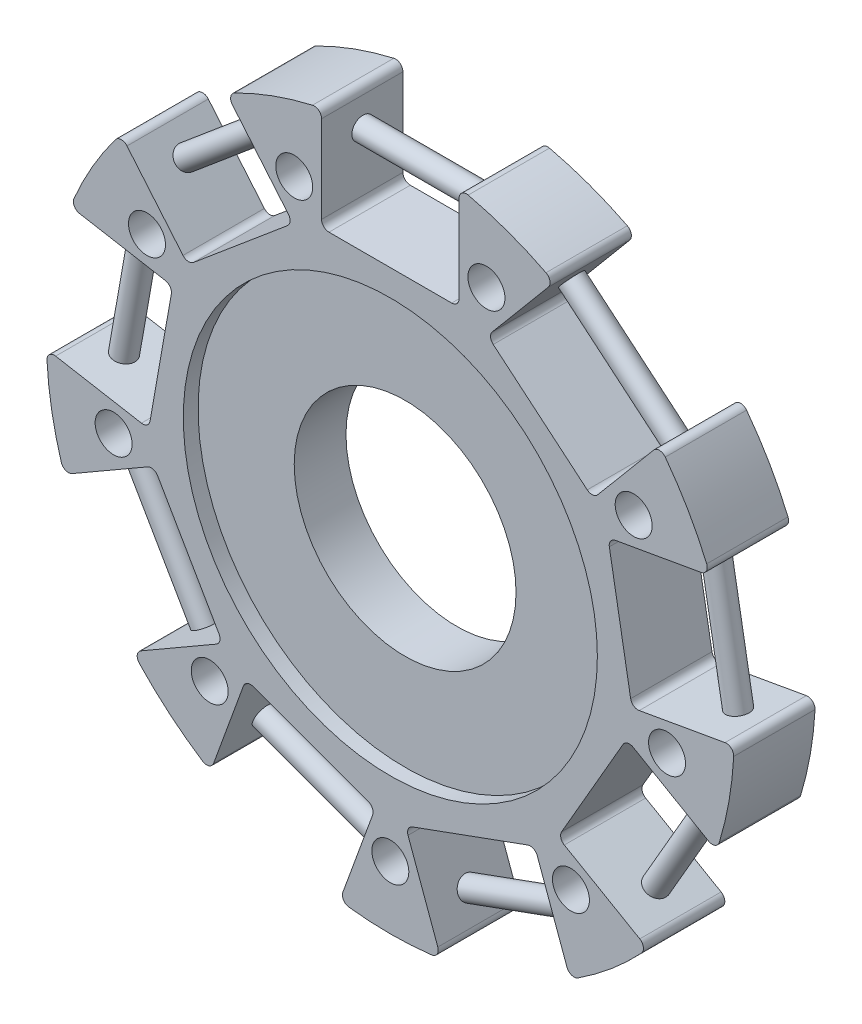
SolidWorks part; units mm, degrees
ref_plane "Front Plane" through (0, 0, 0) normal (0, 0, 1) x (1, 0, 0)
ref_plane "Top Plane" through (0, 0, 0) normal (0, 1, 0) x (1, 0, 0)
ref_plane "Right Plane" through (0, 0, 0) normal (1, 0, 0) x (0, 0, -1)
sketch "Sketch1" plane through (0, 0, 0) normal (0, 0, 1) x (1, 0, 0)
  line L0 (0, 0) -> (0, 31.5376) construction
  line L3 (8.3, 31.5376) -> (-8.3, 31.5376)
  line L4 (-9.3, 32.5376) -> (-9.3, 44.3225)
  line L5 (26.6302, 18.8241) -> (13.9138, 29.4944)
  line L7 (13.7906, 30.9032) -> (21.3657, 39.9309)
  line L8 (-42.0342, 16.8552) -> (-30.4284, 14.8088)
  line L9 (35.6142, 27.9751) -> (28.039, 18.9473)
  line L10 (32.4998, -2.6975) -> (29.6172, 13.6504)
  line L11 (30.4284, 14.8088) -> (42.0342, 16.8552)
  line L13 (45.2641, -1.4622) -> (33.6582, -3.5086)
  line L14 (23.1624, -22.9568) -> (31.4624, -8.5808)
  line L15 (32.8284, -8.2148) -> (43.0344, -14.1072)
  line L16 (-43.0344, -14.1072) -> (-32.8284, -8.2148)
  line L18 (2.9871, -32.4744) -> (18.586, -26.7969)
  line L19 (19.8677, -27.3946) -> (23.8983, -38.4687)
  line L22 (-18.586, -26.7969) -> (-2.9871, -32.4744)
  line L23 (-2.3894, -33.7562) -> (-6.42, -44.8303)
  line L25 (-23.8983, -38.4687) -> (-19.8677, -27.3946)
  line L26 (-31.4624, -8.5808) -> (-23.1624, -22.9568)
  line L27 (-23.5284, -24.3229) -> (-33.7344, -30.2153)
  line L30 (-29.6172, 13.6504) -> (-32.4998, -2.6975)
  line L31 (-33.6582, -3.5086) -> (-45.2641, -1.4622)
  line L32 (33.7344, -30.2153) -> (23.5284, -24.3229)
  line L34 (-13.9138, 29.4944) -> (-26.6302, 18.8241)
  line L35 (-28.039, 18.9473) -> (-35.6142, 27.9751)
  line L37 (-21.3657, 39.9309) -> (-13.7906, 30.9032)
  line L48 (9.3, 44.3225) -> (9.3, 32.5376)
  line L49 (6.42, -44.8303) -> (2.3894, -33.7562)
  arc A0 (-21.0524, 41.4654) -> (-21.3657, 39.9309) centre (-20.5997, 40.5737) ccw
  arc A1 (-10.5264, 45.2965) -> (-21.0524, 41.4654) centre (0, 0) ccw
  arc A2 (-10.5264, 45.2965) -> (-9.3, 44.3225) centre (-10.3, 44.3225) cw
  arc A3 (-37.1797, 27.9329) -> (-35.6142, 27.9751) centre (-36.3802, 27.3323) cw
  arc A4 (-42.7805, 18.2321) -> (-42.0342, 16.8552) centre (-41.8605, 17.84) ccw
  arc A5 (-46.4363, -2.5008) -> (-45.2641, -1.4622) centre (-45.4377, -2.447) cw
  arc A6 (-44.4911, -13.5322) -> (-43.0344, -14.1072) centre (-43.5344, -13.2412) ccw
  arc A7 (-33.9648, -31.7644) -> (-33.7344, -30.2153) centre (-33.2344, -31.0813) cw
  arc A8 (-25.3839, -38.9646) -> (-23.8983, -38.4687) centre (-24.838, -38.1267) ccw
  arc A9 (5.6008, -46.165) -> (6.42, -44.8303) centre (5.4803, -45.1723) ccw
  arc A10 (-5.6008, -46.165) -> (-6.42, -44.8303) centre (-5.4803, -45.1723) cw
  arc A11 (33.9648, -31.7644) -> (33.7344, -30.2153) centre (33.2344, -31.0813) ccw
  arc A12 (25.3839, -38.9646) -> (23.8983, -38.4687) centre (24.838, -38.1267) cw
  arc A13 (-37.1797, 27.9329) -> (-42.7805, 18.2321) centre (0, 0) ccw
  arc A14 (44.4911, -13.5322) -> (43.0344, -14.1072) centre (43.5344, -13.2412) cw
  arc A15 (-46.4363, -2.5008) -> (-44.4911, -13.5322) centre (0, 0) ccw
  arc A16 (46.4363, -2.5008) -> (45.2641, -1.4622) centre (45.4377, -2.447) ccw
  arc A17 (-33.9648, -31.7644) -> (-25.3839, -38.9646) centre (0, 0) ccw
  arc A18 (42.0342, 16.8552) -> (42.7805, 18.2321) centre (41.8605, 17.84) ccw
  arc A19 (-5.6008, -46.165) -> (5.6008, -46.165) centre (0, 0) ccw
  arc A20 (37.1797, 27.9329) -> (35.6142, 27.9751) centre (36.3802, 27.3323) ccw
  arc A21 (25.3839, -38.9646) -> (33.9648, -31.7644) centre (0, 0) ccw
  arc A22 (44.4911, -13.5322) -> (46.4363, -2.5008) centre (0, 0) ccw
  arc A23 (21.0524, 41.4654) -> (21.3657, 39.9309) centre (20.5997, 40.5737) cw
  arc A24 (42.7805, 18.2321) -> (37.1797, 27.9329) centre (0, 0) ccw
  arc A25 (10.5264, 45.2965) -> (9.3, 44.3225) centre (10.3, 44.3225) ccw
  arc A26 (21.0524, 41.4654) -> (10.5264, 45.2965) centre (0, 0) ccw
  arc A27 (-23.1624, -22.9568) -> (-23.5284, -24.3229) centre (-24.0284, -23.4568) cw
  arc A28 (-18.586, -26.7969) -> (-19.8677, -27.3946) centre (-18.928, -27.7366) ccw
  arc A29 (-2.9871, -32.4744) -> (-2.3894, -33.7562) centre (-3.3291, -33.4141) cw
  arc A30 (2.9871, -32.4744) -> (2.3894, -33.7562) centre (3.3291, -33.4141) ccw
  arc A31 (18.586, -26.7969) -> (19.8677, -27.3946) centre (18.928, -27.7366) cw
  arc A32 (23.1624, -22.9568) -> (23.5284, -24.3229) centre (24.0284, -23.4568) ccw
  arc A33 (31.4624, -8.5808) -> (32.8284, -8.2148) centre (32.3284, -9.0808) cw
  arc A34 (32.4998, -2.6975) -> (33.6582, -3.5086) centre (33.4846, -2.5238) ccw
  arc A35 (29.6172, 13.6504) -> (30.4284, 14.8088) centre (30.602, 13.824) cw
  arc A36 (26.6302, 18.8241) -> (28.039, 18.9473) centre (27.273, 19.5901) ccw
  arc A37 (-32.4998, -2.6975) -> (-33.6582, -3.5086) centre (-33.4846, -2.5238) cw
  arc A38 (-31.4624, -8.5808) -> (-32.8284, -8.2148) centre (-32.3284, -9.0808) ccw
  arc A39 (13.9138, 29.4944) -> (13.7906, 30.9032) centre (14.5566, 30.2604) cw
  arc A40 (9.3, 32.5376) -> (8.3, 31.5376) centre (8.3, 32.5376) cw
  arc A41 (-8.3, 31.5376) -> (-9.3, 32.5376) centre (-8.3, 32.5376) cw
  arc A42 (-13.9138, 29.4944) -> (-13.7906, 30.9032) centre (-14.5566, 30.2604) ccw
  arc A43 (-26.6302, 18.8241) -> (-28.039, 18.9473) centre (-27.273, 19.5901) cw
  arc A44 (-29.6172, 13.6504) -> (-30.4284, 14.8088) centre (-30.602, 13.824) ccw
  point P22 (0, 0)
  point P66 (0, 0)
  dimension "D1" = 1
  dimension "D3" = 1
  dimension "D4" = 1
  dimension "D2" = 9
extrude "Boss-Extrude1" add sketch "Sketch1" along normal blind 11
sketch "Sketch3" plane through (0, 0, 11) normal (0, 0, 1) x (1, 0, 0)
  circle A0 centre (12.9968, 35.7083) radius 2.5
  circle A1 centre (-12.9968, 35.7083) radius 2.5
  circle A2 centre (32.909, 19) radius 2.5
  circle A3 centre (37.4227, -6.5986) radius 2.5
  circle A4 centre (24.4259, -29.1097) radius 2.5
  circle A5 centre (0, -38) radius 2.5
  circle A6 centre (-24.4259, -29.1097) radius 2.5
  circle A7 centre (-37.4227, -6.5986) radius 2.5
  circle A8 centre (-32.909, 19) radius 2.5
  point P25 (0, 0)
  dimension "D1" = 9
  dimension "D2" = 5
extrude "Cut-Extrude4" cut sketch "Sketch3" against normal blind 11
sketch "Sketch7" plane through (0, 0, 11) normal (0, 0, 1) x (1, 0, 0)
  circle A0 centre (0, 0) radius 28
extrude "Cut-Extrude5" cut sketch "Sketch7" against normal blind 2
sketch "Sketch10" plane through (0, 0, 0) normal (0, 0, -1) x (-1, 0, 0)
  circle A0 centre (0, 0) radius 28
extrude "Cut-Extrude6" cut sketch "Sketch10" against normal blind 2
sketch "Sketch12" plane through (0, 0, 2) normal (0, 0, -1) x (-1, 0, 0)
  circle A0 centre (0, 0) radius 15
extrude "Cut-Extrude7" cut sketch "Sketch12" against normal through all
sketch "Sketch13" plane through (7.1242, -5.9779, 0) normal (-0.766, 0.6428, 0) x (0, 0, 1)
  line L0 (11, 32.5376) -> (0, 32.5376) construction
  circle A0 centre (5.5, 40.5376) radius 1.5
  dimension "D1" = 8
extrude "Boss-Extrude2" add sketch "Sketch13" along normal blind 18.5
pattern_circular "CirPattern1" count 9 over 360 about axis through (0, 0, 0) along (0, 0, 1) of "Boss-Extrude2"
sketch "Sketch15" plane through (0, 0, 2) normal (0, 0, -1) x (-1, 0, 0)
  line L0 (0, 0) -> (0, 50)
  dimension "D1" = 50
sketch "Sketch16" plane through (0, 0, 0) normal (0, 0, -1) x (-1, 0, 0)
  circle A0 centre (0, 0) radius 49.8472
  dimension "D1" = 99.6945
